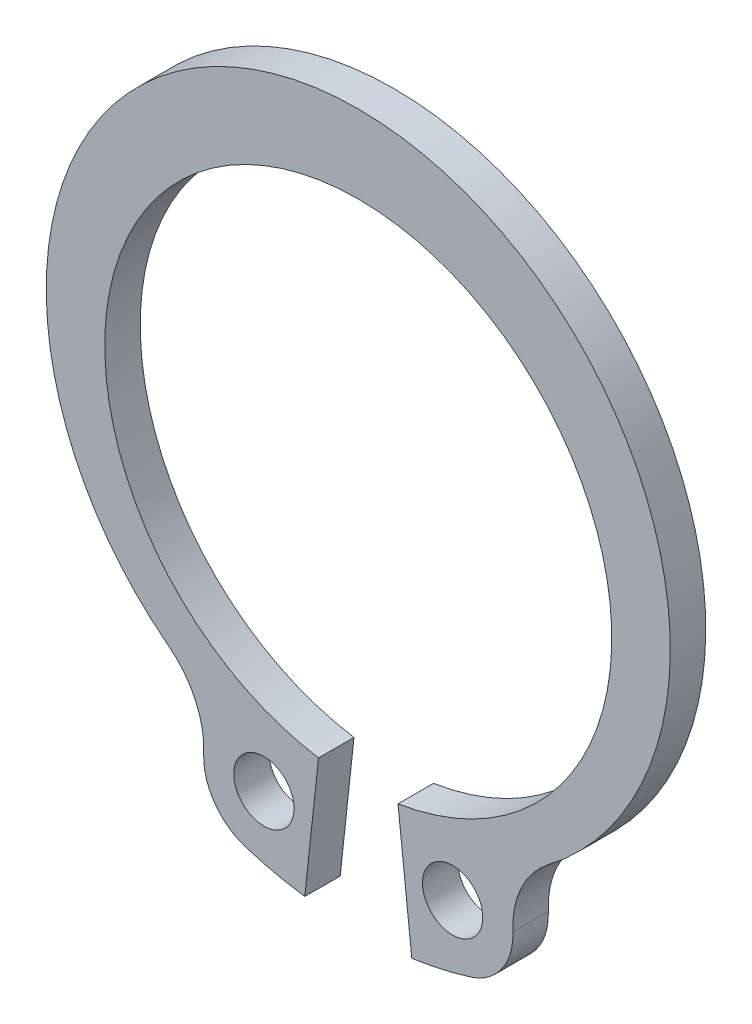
SolidWorks part; units mm, degrees
ref_plane "Face" through (0, 0, 0) normal (0, 0, 1) x (1, 0, 0)
ref_plane "Dessus" through (0, 0, 0) normal (0, 1, 0) x (1, 0, 0)
ref_plane "Droite" through (0, 0, 0) normal (1, 0, 0) x (0, 0, -1)
sketch "Esquisse1" plane through (0, 0, 0) normal (0, 0, 1) x (1, 0, 0)
  line L0 (0, 9.35) -> (0, 7.15) construction
  line L1 (1.1209, -7.0616) -> (1.5094, -10.6406)
  line L2 (-1.1209, -7.0616) -> (-1.5094, -10.6406)
  line L3 (0.34, -6.8916) -> (0.34, -10.4916) construction
  line L4 (-0.34, -6.8916) -> (-0.34, -10.4916) construction
  arc A0 (1.1209, -7.0616) -> (-1.1209, -7.0616) centre (0, 0) ccw
  arc A1 (5.355, -6.4331) -> (-5.355, -6.4331) centre (0, 0.55) ccw
  arc A2 (1.5094, -10.6406) -> (3.161, -10.2717) centre (0, 0) ccw
  circle A3 centre (2.661, -8.6469) radius 0.85
  arc A4 (3.161, -10.2717) -> (4.3593, -8.5708) centre (2.661, -8.6469) ccw
  arc A5 (5.355, -6.4331) -> (4.3593, -8.5708) centre (6.9067, -8.4567) ccw
  circle A6 centre (-2.661, -8.6469) radius 0.85
  arc A7 (-5.355, -6.4331) -> (-4.3593, -8.5708) centre (-6.9067, -8.4567) cw
  arc A8 (-3.161, -10.2717) -> (-4.3593, -8.5708) centre (-2.661, -8.6469) cw
  arc A9 (-1.5094, -10.6406) -> (-3.161, -10.2717) centre (0, 0) cw
  arc A10 (0.34, -6.8916) -> (-0.34, -6.8916) centre (0, 0) ccw construction
  circle A11 centre (0, 0) radius 7.5 construction
  dimension "dgorge" = 14.3
  dimension "D3" = 0.55
  dimension "dtrou" = 1.7
  dimension "D8" = 1.7
  dimension "D9" = 2.55
  dimension "dint" = 13.8
  dimension "dn" = 15
  dimension "b" = 2.2
  dimension "a" = 3.6
  dimension "D5" = 18.039
  dimension "D7" = 1.36
  dimension "D12" = 0.68
  dimension "D13" = 5.649
  dimension "D14" = 6.195
extrude "Base-Extrusion" add sketch "Esquisse1" along normal blind 1
equation "\"D3@Esquisse1\" = \"b@Esquisse1\"/4"
equation "\"D7@Esquisse1\"=\"dtrou@Esquisse1\"*0.8"
equation "\"D8@Esquisse1\" = \"dtrou@Esquisse1\""
equation "\"D9@Esquisse1\" = \"dtrou@Esquisse1\"*1.5"
equation "\"D12@Esquisse1\" = \"dtrou@Esquisse1\"*0.4"
equation "\"D5@Esquisse1\" = 360-(360-\"D13@Esquisse1\")*\"dint@Esquisse1\"/\"dgorge@Esquisse1\""
equation "\"D14@Esquisse1\" = (\"D5@Esquisse1\"-\"D13@Esquisse1\")/2"
